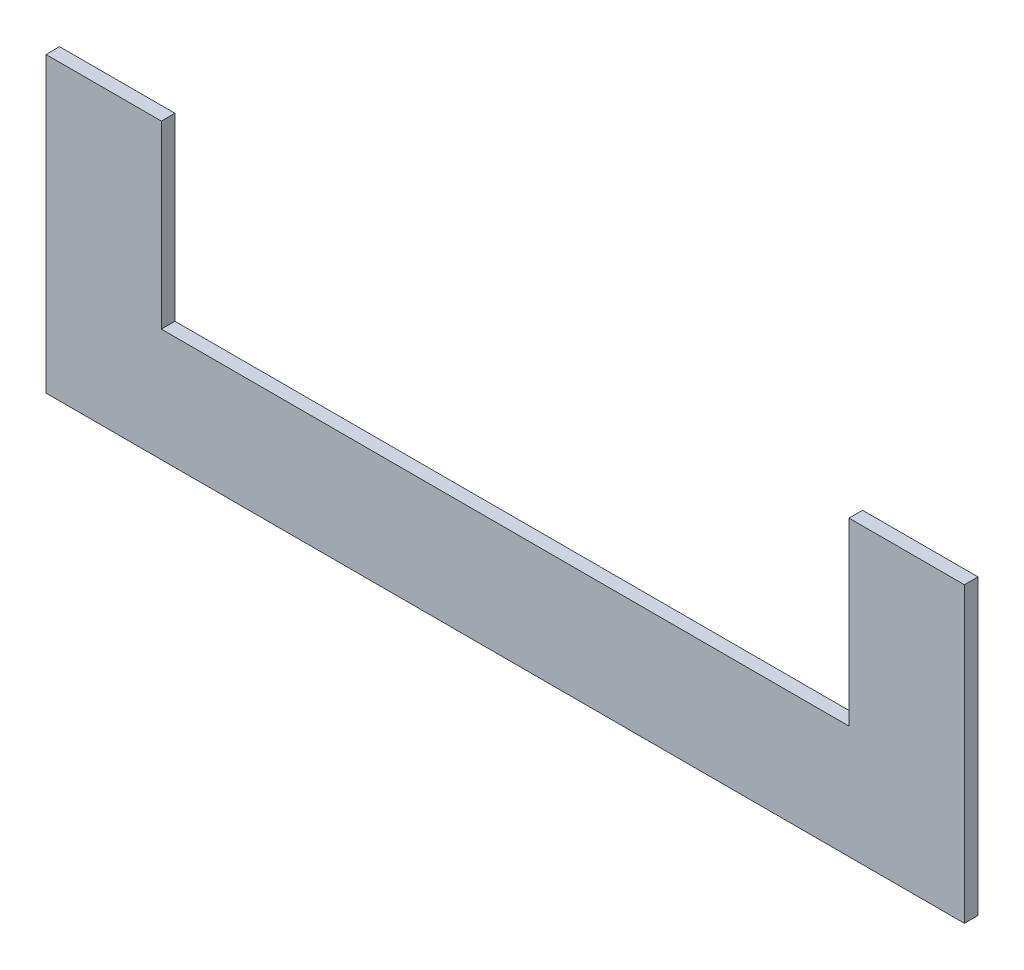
SolidWorks part; units mm, degrees
ref_plane "Piano frontale" through (0, 0, 0) normal (0, 0, 1) x (1, 0, 0)
ref_plane "Piano superiore" through (0, 0, 0) normal (0, 1, 0) x (1, 0, 0)
ref_plane "Piano destro" through (0, 0, 0) normal (1, 0, 0) x (0, 0, -1)
sketch "Sketch1" plane through (0, 0, 0) normal (0, 0, 1) x (1, 0, 0)
  line L0 (-152, -14.82) -> (152, -14.82)
  line L1 (203, -64.82) -> (-203, -64.82)
  line L2 (203, -64.82) -> (203, 64.82)
  line L3 (-203, 64.82) -> (-152, 64.82)
  line L4 (-203, -64.82) -> (-203, 64.82)
  line L5 (203, -64.82) -> (-203, 64.82) construction
  line L6 (203, 64.82) -> (-203, -64.82) construction
  line L7 (-152, -14.82) -> (-152, 64.82)
  line L8 (152, -14.82) -> (152, 64.82)
  line L10 (152, 64.82) -> (203, 64.82)
  point P0 (0, 0)
  dimension "D1" = 129.64
  dimension "D2" = 50
  dimension "D3" = 51
  dimension "D4" = 51
  dimension "D5" = 406
  dimension "D6" = 129.64
extrude "Boss-Extrude1" add sketch "Sketch1" along normal blind 6
